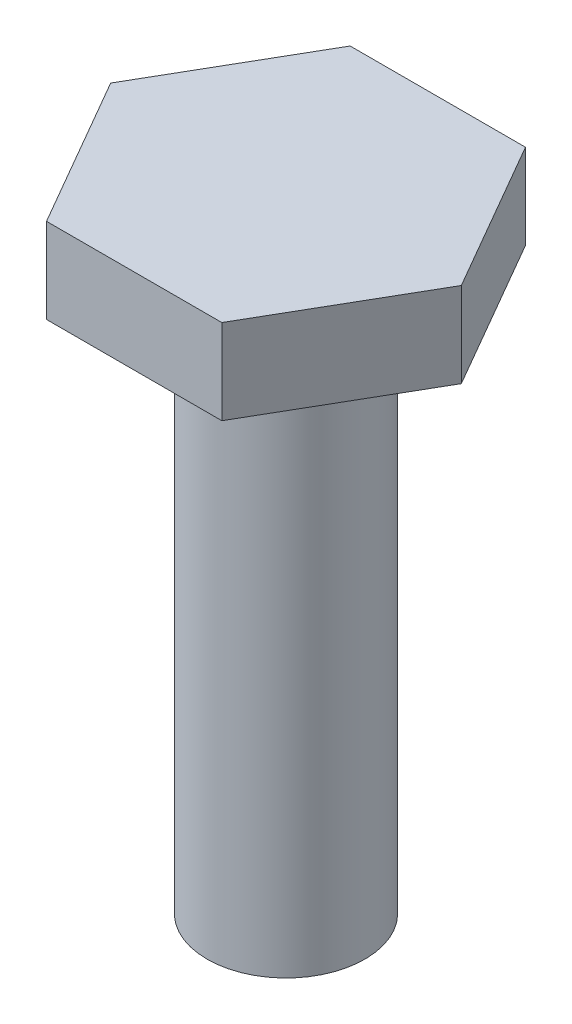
SolidWorks part; units mm, degrees
ref_plane "Front Plane" through (0, 0, 0) normal (0, 0, 1) x (1, 0, 0)
ref_plane "Top Plane" through (0, 0, 0) normal (0, 1, 0) x (1, 0, 0)
ref_plane "Right Plane" through (0, 0, 0) normal (1, 0, 0) x (0, 0, -1)
sketch "Sketch2" plane through (0, 0, 0) normal (0, 1, 0) x (1, 0, 0)
  circle A0 centre (0, 0) radius 1.651
  dimension "D1" = 3.302
extrude "Boss-Extrude1" add sketch "Sketch2" along normal blind 11.43
sketch "Sketch3" plane through (0, 11.43, 0) normal (0, 1, 0) x (1, 0, 0)
  line L1 (3.6662, 0) -> (1.8331, 3.175)
  line L2 (1.8331, 3.175) -> (-1.8331, 3.175)
  line L3 (-1.8331, 3.175) -> (-3.6662, 0)
  line L4 (-3.6662, 0) -> (-1.8331, -3.175)
  line L5 (-1.8331, -3.175) -> (1.8331, -3.175)
  line L6 (1.8331, -3.175) -> (3.6662, 0)
  circle A0 centre (0, 0) radius 3.175 construction
  dimension "D1" = 6.35
extrude "Boss-Extrude2" add sketch "Sketch3" along normal blind 1.778
